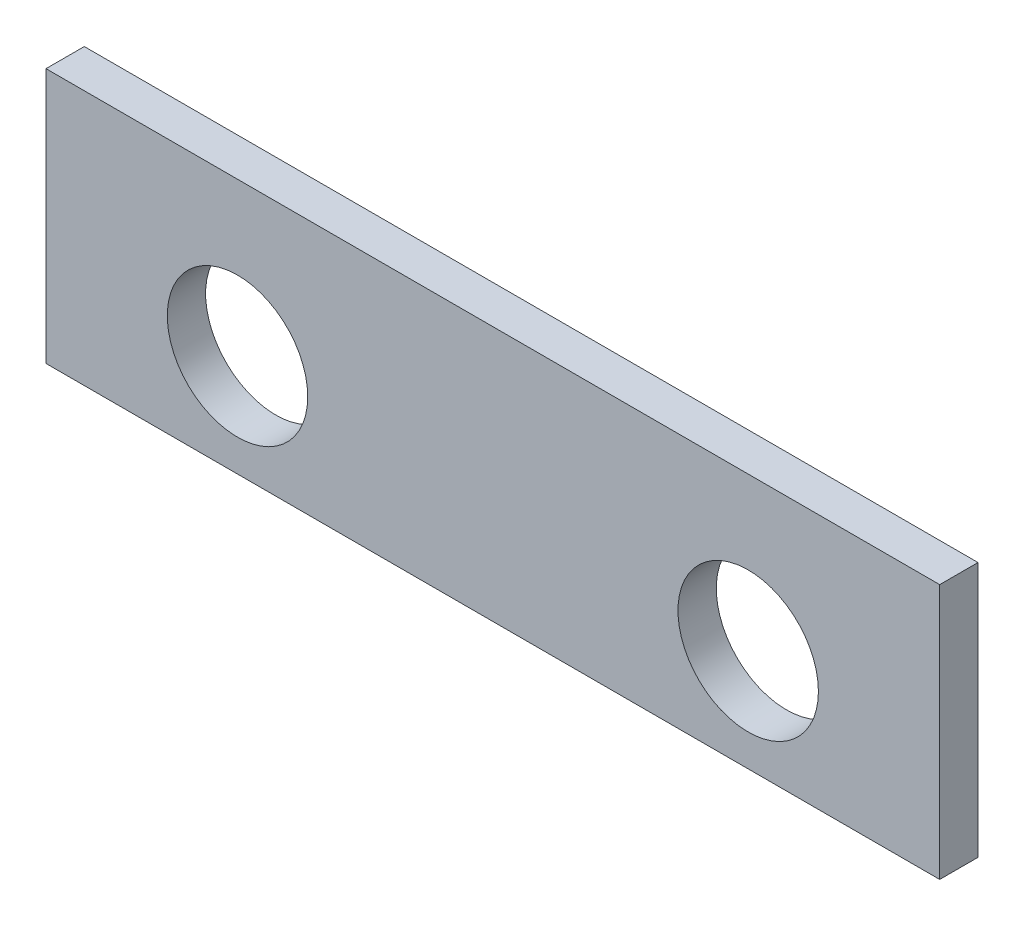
SolidWorks part; units mm, degrees
ref_plane "Plan de face" through (0, 0, 0) normal (0, 0, 1) x (1, 0, 0)
ref_plane "Plan de dessus" through (0, 0, 0) normal (0, 1, 0) x (1, 0, 0)
ref_plane "Plan de droite" through (0, 0, 0) normal (1, 0, 0) x (0, 0, -1)
sketch "Esquisse1" plane through (0, 0, 0) normal (0, 0, 1) x (1, 0, 0)
  line L1 (0, 0) -> (70, 0)
  line L2 (0, 0) -> (0, 20)
  line L3 (0, 20) -> (70, 20)
  line L4 (70, 0) -> (70, 20)
  circle A0 centre (15, 8) radius 5.5
  circle A1 centre (55, 8) radius 5.5
  dimension "D3" = 11
  dimension "D4" = 11
  dimension "D6" = 8
  dimension "D7" = 15
  dimension "D8" = 40
  dimension "D1" = 70
  dimension "D2" = 20
  dimension "D5" = 8
extrude "Extrusion1" add sketch "Esquisse1" along normal blind 3
